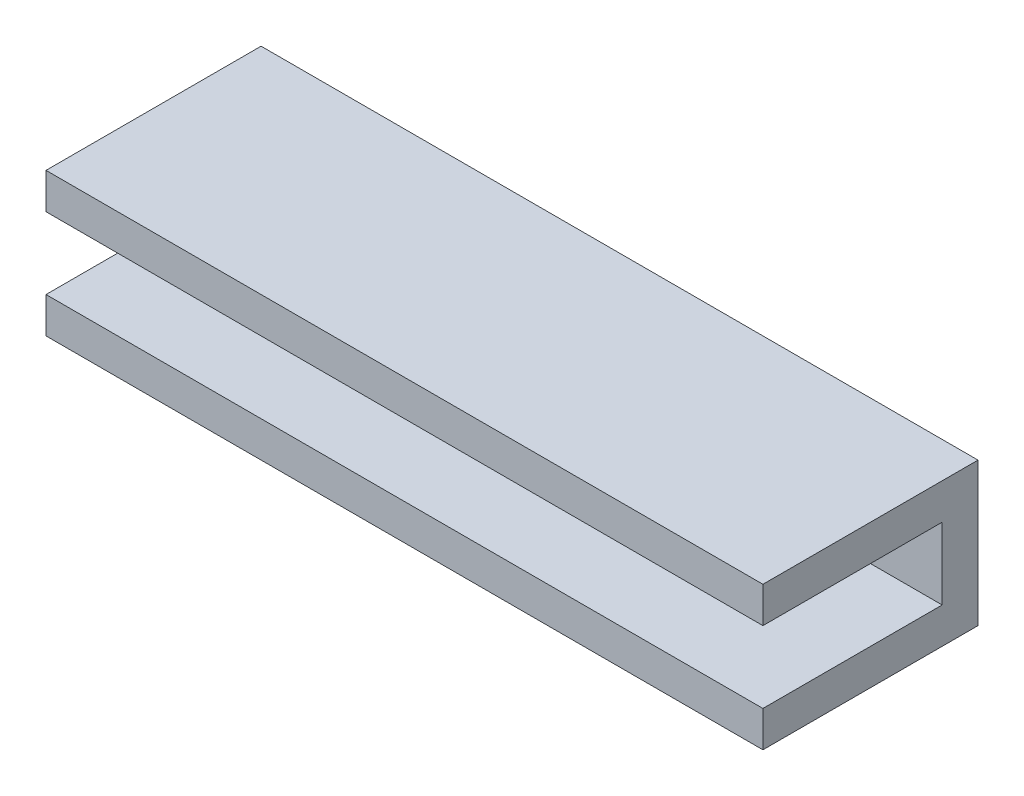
SolidWorks part; units mm, degrees
ref_plane "Front Plane" through (0, 0, 0) normal (0, 0, 1) x (1, 0, 0)
ref_plane "Top Plane" through (0, 0, 0) normal (0, 1, 0) x (1, 0, 0)
ref_plane "Right Plane" through (0, 0, 0) normal (1, 0, 0) x (0, 0, -1)
sketch "Sketch2" plane through (0, 0, 0) normal (0, 0, 1) x (1, 0, 0)
  line L0 (0, 0) -> (100, 0)
  line L1 (100, 0) -> (100, 20)
  line L2 (100, 20) -> (0, 20)
  line L3 (0, 20) -> (0, 0)
  dimension "D1" = 100
  dimension "D2" = 20
extrude "Boss-Extrude1" add sketch "Sketch2" along normal blind 30
sketch "Sketch3" plane through (100, 0, 0) normal (1, 0, 0) x (0, 0, -1)
  line L0 (-30, 0) -> (-30, 20) construction
  line L1 (-30, 5) -> (-5, 5)
  line L2 (-5, 5) -> (-5, 15)
  line L3 (-5, 15) -> (-30, 15)
  line L4 (-30, 20) -> (0, 20) construction
  line L5 (-30, 0) -> (0, 0) construction
  line L6 (0, 0) -> (0, 20) construction
  line L7 (-30, 15) -> (-30, 5)
  dimension "D1" = 5
  dimension "D2" = 5
  dimension "D3" = 5
extrude "Cut-Extrude2" cut sketch "Sketch3" against normal through all
sketch "Sketch4" plane through (0, 0, 5) normal (0, 0, 1) x (1, 0, 0)
  circle A0 centre (50, 10) radius 2
  dimension "D1" = 4
extrude "Cut-Extrude3" cut sketch "Sketch4" against normal through all
